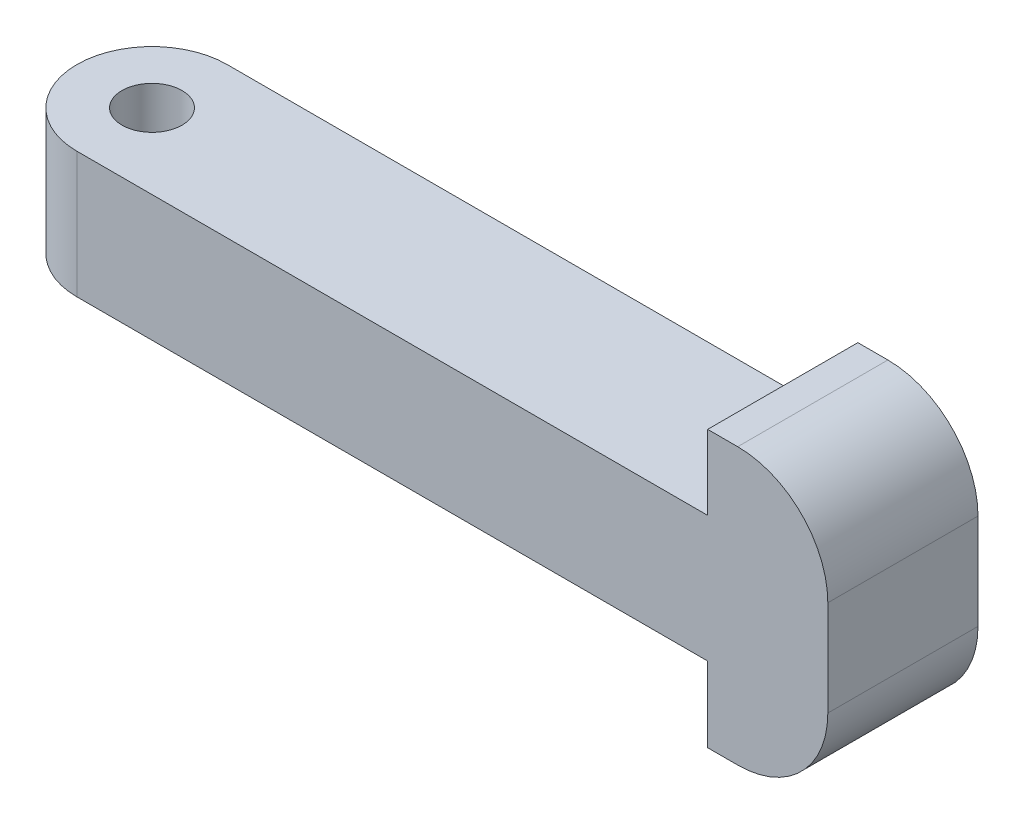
SolidWorks part; units mm, degrees
ref_plane "Front Plane" through (0, 0, 0) normal (0, 0, 1) x (1, 0, 0)
ref_plane "Top Plane" through (0, 0, 0) normal (0, 1, 0) x (1, 0, 0)
ref_plane "Right Plane" through (0, 0, 0) normal (1, 0, 0) x (0, 0, -1)
sketch "Sketch1" plane through (0, 0, 0) normal (0, 1, 0) x (1, 0, 0)
  line L1 (-2.5, 2.5) -> (21, 2.5)
  line L2 (-2.5, 2.5) -> (-2.5, -2.5)
  line L3 (-2.5, -2.5) -> (21, -2.5)
  line L4 (21, 2.5) -> (21, -2.5)
  circle A0 centre (0, 0) radius 1
  dimension "D1" = 2
  dimension "D2" = 21
  dimension "D4" = 2.5
  dimension "D3" = 2.5
  dimension "D5" = 5
extrude "Boss-Extrude1" add sketch "Sketch1" along normal mid plane 4.2
sketch "Sketch2" plane through (0, 0, -2.5) normal (0, 0, -1) x (-1, 0, 0)
  line L1 (-21, -2.1) -> (-25, -2.1)
  line L2 (-21, -2.1) -> (-21, 2.0803)
  line L3 (-21, 2.0803) -> (-25, 2.0803)
  line L4 (-25, -2.1) -> (-25, 2.0803)
  line L5 (-21, -2.1) -> (-25, -2.1)
  line L6 (-21, -2.1) -> (-21, -4.6)
  line L7 (-21, -4.6) -> (-25, -4.6)
  line L8 (-25, -2.1) -> (-25, -4.6)
  line L9 (-21, 2.0803) -> (-25, 2.0803)
  line L10 (-21, 2.0803) -> (-21, 4.5803)
  line L11 (-21, 4.5803) -> (-25, 4.5803)
  line L12 (-25, 2.0803) -> (-25, 4.5803)
  dimension "D1" = 2.5
  dimension "D2" = 2.5
  dimension "D3" = 4
extrude "Boss-Extrude2" add sketch "Sketch2" against normal blind 5 contours L1 L8 L7 L6 | L4 L1 L3 M4 | L12 L3 L10 L11 M4
fillet "Fillet1" radius 3 2 edges at (25, -4.6, 0) (25, 4.5803, 0)
fillet "Fillet2" radius 2.5 2 edges at (-2.5, 0, 2.5) (-2.5, 0, -2.5)
equation "\"D5@Sketch1\"=\"D4@Sketch1\"*2"
equation "\"D2@Sketch2\"=\"D1@Sketch2\""
